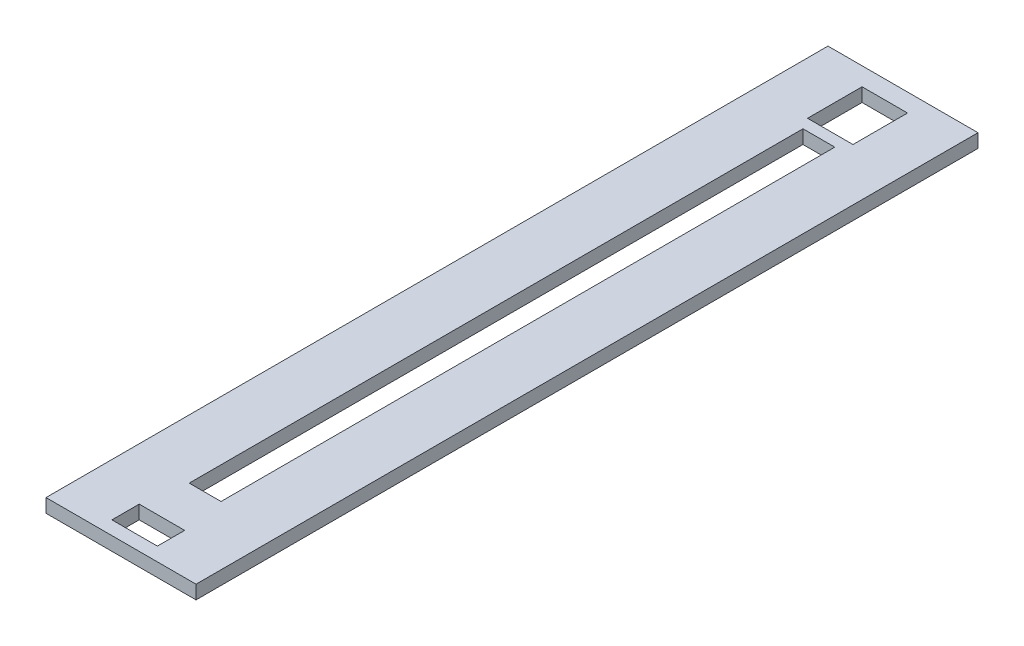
SolidWorks part; units mm, degrees
ref_plane "Front Plane" through (0, 0, 0) normal (0, 0, 1) x (1, 0, 0)
ref_plane "Top Plane" through (0, 0, 0) normal (0, 1, 0) x (1, 0, 0)
ref_plane "Right Plane" through (0, 0, 0) normal (1, 0, 0) x (0, 0, -1)
sketch "Sketch1" plane through (0, 0, 0) normal (0, 1, 0) x (1, 0, 0)
  line L1 (-16.5, 86) -> (16.5, 86)
  line L2 (-16.5, 86) -> (-16.5, -86)
  line L3 (-16.5, -86) -> (16.5, -86)
  line L4 (16.5, 86) -> (16.5, -86)
  line L5 (-16.5, 86) -> (16.5, -86) construction
  line L6 (-16.5, -86) -> (16.5, 86) construction
  line L7 (-5, 82) -> (5, 82)
  line L8 (-5, 82) -> (-5, 70)
  line L9 (-5, 70) -> (5, 70)
  line L10 (5, 82) -> (5, 70)
  line L11 (-5, 82) -> (5, 70) construction
  line L12 (-5, 70) -> (5, 82) construction
  line L13 (-3.5, 67.5) -> (3.5, 67.5)
  line L14 (-3.5, 67.5) -> (-3.5, -67.5)
  line L15 (-3.5, -67.5) -> (3.5, -67.5)
  line L16 (3.5, 67.5) -> (3.5, -67.5)
  line L17 (-3.5, 67.5) -> (3.5, -67.5) construction
  line L18 (-3.5, -67.5) -> (3.5, 67.5) construction
  line L19 (-5, -77) -> (5, -77)
  line L20 (-5, -77) -> (-5, -83)
  line L21 (-5, -83) -> (5, -83)
  line L22 (5, -77) -> (5, -83)
  line L23 (-5, -77) -> (5, -83) construction
  line L24 (-5, -83) -> (5, -77) construction
  point P0 (0, 0)
  point P6 (0, 76)
  point P11 (0, 0)
  point P16 (0, -80)
  dimension "D1" = 172
  dimension "D2" = 33
  dimension "D3" = 10
  dimension "D4" = 12
  dimension "D5" = 10
  dimension "D6" = 7
  dimension "D7" = 135
  dimension "D8" = 6
  dimension "D9" = 10
  dimension "D10" = 6
extrude "Boss-Extrude1" add sketch "Sketch1" along normal blind 3
